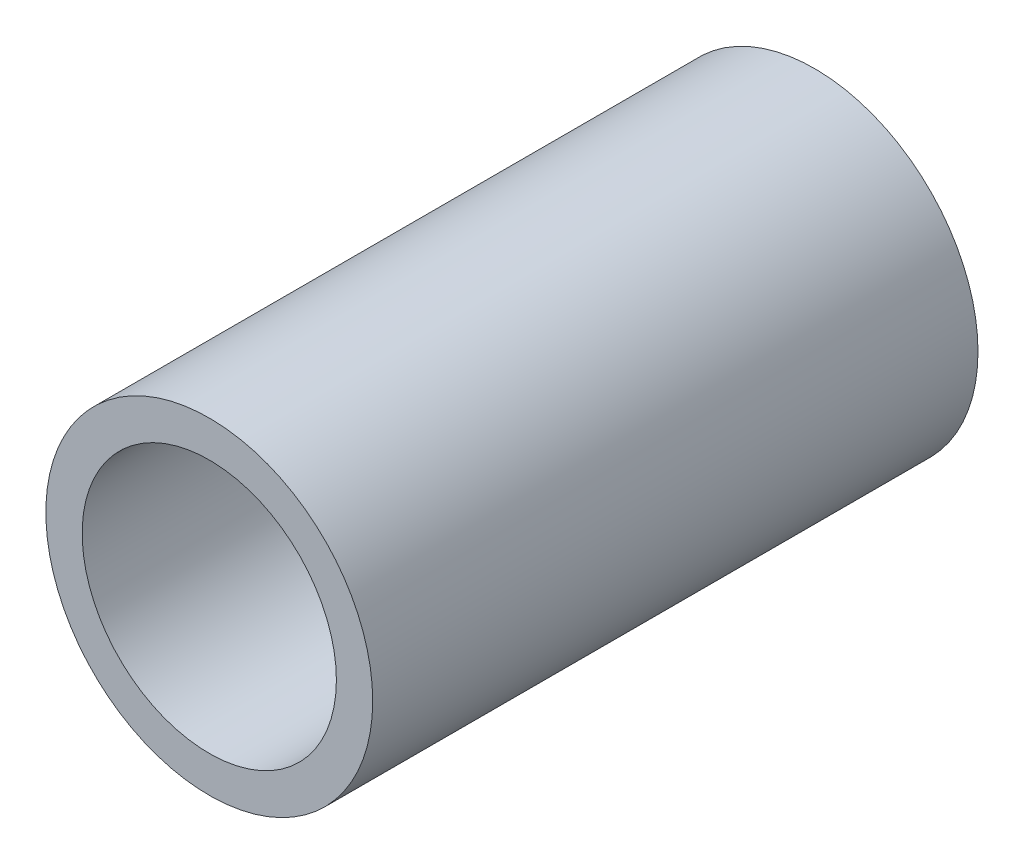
SolidWorks part; units mm, degrees
ref_plane "Face" through (0, 0, 0) normal (0, 0, 1) x (1, 0, 0)
ref_plane "Dessus" through (0, 0, 0) normal (0, 1, 0) x (1, 0, 0)
ref_plane "Droite" through (0, 0, 0) normal (1, 0, 0) x (0, 0, -1)
sketch "Esquisse1" plane through (0, 0, 0) normal (0, 0, 1) x (1, 0, 0)
  circle A0 centre (0, 0) radius 10.5
extrude "Extru.-Mince1" add sketch "Esquisse1" along normal blind 50 thin
